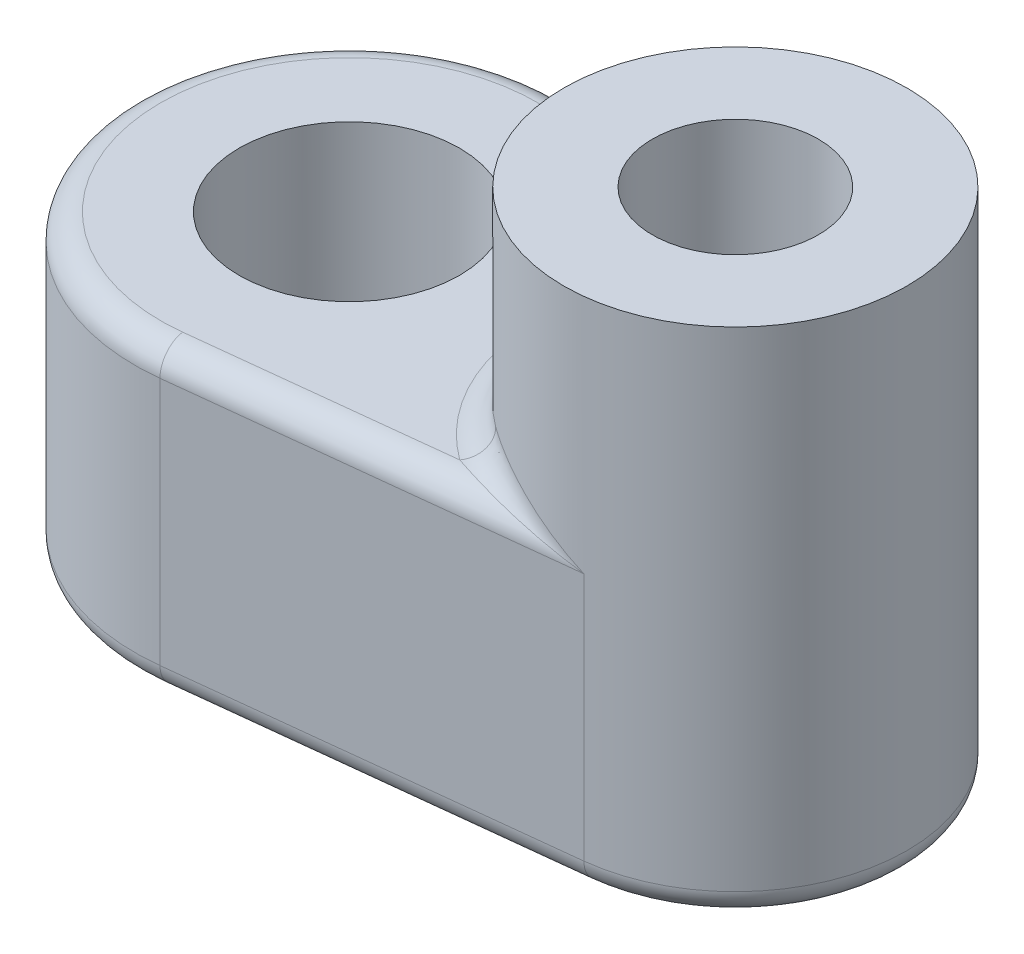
SolidWorks part; units mm, degrees
ref_plane "Front Plane" through (0, 0, 0) normal (0, 0, 1) x (1, 0, 0)
ref_plane "Top Plane" through (0, 0, 0) normal (0, 1, 0) x (1, 0, 0)
ref_plane "Right Plane" through (0, 0, 0) normal (1, 0, 0) x (0, 0, -1)
sketch "Sketch1" plane through (0, 0, 0) normal (0, 1, 0) x (1, 0, 0)
  line L0 (-10.7244, -6.3107) -> (0.5644, -5.0485)
  line L1 (-10.7244, 6.3107) -> (0.5644, 5.0485)
  arc A2 (-10.7244, 6.3107) -> (-10.7244, -6.3107) centre (-11.43, 0) ccw
  arc A3 (0.5644, -5.0485) -> (0.5644, 5.0485) centre (0, 0) ccw
  dimension "D1" = 11.43
  dimension "D3" = 10.16
  dimension "D2" = 12.7
extrude "Boss-Extrude1" add sketch "Sketch1" along normal blind 8.89
sketch "Sketch2" plane through (0, 8.89, 0) normal (0, 1, 0) x (1, 0, 0)
  circle A0 centre (0, 0) radius 5.08
  arc A2 (0.5644, -5.0485) -> (0.5644, 5.0485) centre (0, 0) ccw construction
extrude "Boss-Extrude2" add sketch "Sketch2" along normal blind 6.35
hole_wizard "#10 (0.1935) Diameter Hole1" positions "Sketch4" profile "Sketch3" hole size "#10" standard "ANSI Inch"
sketch "Sketch4" plane through (0, 0, 0) normal (0, -1, 0) x (-1, 0, 0)
  arc A1 (-0.5644, 5.0485) -> (-0.5644, -5.0485) centre (0, 0) ccw construction
  point P0 (0, 0)
sketch "Sketch3" plane through (0, 0, 0) normal (1, 0, 0) x (0, 0, -1)
  line L0 (0, 0) -> (0, 15.24)
  line L1 (0, 15.24) -> (2.4574, 15.24)
  line L2 (2.4574, 15.24) -> (2.4574, 0)
  line L5 (2.4574, 0) -> (0, 0)
  line L11 (0, -6.35) -> (0, 107.95) construction
  dimension "Thru Hole Dia." = 4.9149
  dimension "Thru Hole Depth" = 15.24
hole_wizard "5/16-18 Tapped Hole1" positions "Sketch6" profile "Sketch5" tap size "5/16-18" standard "ANSI Inch"
sketch "Sketch6" plane through (0, 0, 0) normal (0, -1, 0) x (-1, 0, 0)
  arc A1 (10.7244, -6.3107) -> (10.7244, 6.3107) centre (11.43, 0) ccw construction
  point P0 (11.43, 0)
sketch "Sketch5" plane through (-11.43, 0, 0) normal (1, 0, 0) x (0, 0, -1)
  line L0 (0, 0) -> (0, 15.24)
  line L1 (0, 15.24) -> (3.2639, 15.24)
  line L2 (3.2639, 15.24) -> (3.2639, 0)
  line L5 (3.2639, 0) -> (0, 0)
  line L11 (0, -6.35) -> (0, 107.95) construction
  dimension "Thru Tap Drill Dia." = 6.5278
  dimension "Thru Tap Drill Depth" = 15.24
fillet "Fillet1" radius 0.762 8 edges at (-17.78, 0, 0) (-5.08, 0, -5.6796) (5.08, 0, 0) (-17.78, 8.89, 0) (-5.08, 0, 5.6796)
